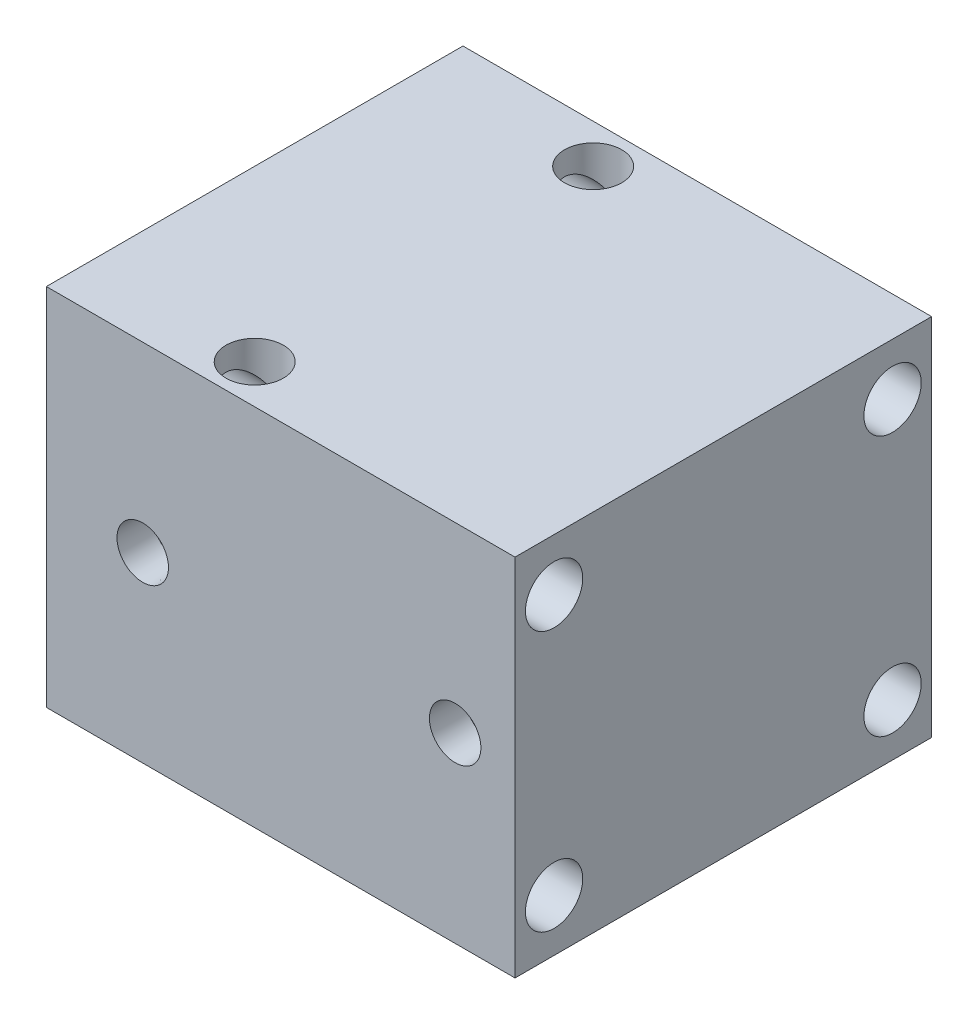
SolidWorks part; units mm, degrees
ref_plane "Front Plane" through (0, 0, 0) normal (0, 0, 1) x (1, 0, 0)
ref_plane "Top Plane" through (0, 0, 0) normal (0, 1, 0) x (1, 0, 0)
ref_plane "Right Plane" through (0, 0, 0) normal (1, 0, 0) x (0, 0, -1)
sketch "Sketch1" plane through (0, 0, 0) normal (0, 1, 0) x (1, 0, 0)
  line L0 (-25, 65) -> (-25, -65) construction
  line L1 (-90, 80) -> (90, 80)
  line L2 (-90, 80) -> (-90, -80)
  line L3 (-90, -80) -> (90, -80)
  line L4 (90, 80) -> (90, -80)
  line L5 (-90, 0) -> (-25, 0) construction
  circle A0 centre (-25, 65) radius 11
  circle A1 centre (-25, -65) radius 11
  dimension "D5" = 22
  dimension "D6" = 22
  dimension "D8" = 65
  dimension "D1" = 160
  dimension "D2" = 80
  dimension "D3" = 180
  dimension "D4" = 90
  dimension "D7" = 130
extrude "H1" add sketch "Sketch1" along normal blind 140
sketch "Sketch2" plane through (-90, 0, 0) normal (-1, 0, 0) x (0, 0, 1)
  line L0 (0, 0) -> (0, 70) construction
  line L1 (80, 70) -> (0, 70) construction
  line L2 (80, 140) -> (80, 0) construction
  circle A0 centre (0, 70) radius 1.5
  dimension "D1" = 3
extrude "CENTER HOLE" cut sketch "Sketch2" against normal blind 60
hole_wizard "1/2 NPT Tapped Hole1" positions "Sketch4" profile "Sketch3" size "1/2" standard "Ansi Inch"
sketch "Sketch4" plane through (0, 0, 80) normal (0, 0, 1) x (1, 0, 0)
  line L0 (-90, 70) -> (90, 70) construction
  line L1 (-90, 140) -> (-90, 0) construction
  line L2 (90, 140) -> (90, 0) construction
  point P0 (67, 70)
  point P1 (-53, 70)
  dimension "D1" = 37
  dimension "D2" = 23
sketch "Sketch3" plane through (67, 70, 80) normal (1, 0, 0) x (0, -1, 0)
  line L0 (0, 0) -> (0, 28.0045)
  line L1 (8.9281, 22.64) -> (0, 28.0045)
  line L2 (-8.9281, 22.64) -> (0, 28.0045) construction
  line L3 (8.9281, 22.64) -> (8.9281, 13.57)
  line L4 (8.9281, 13.57) -> (9.4797, 13.57)
  line L5 (9.4797, 13.57) -> (9.886, 0)
  line L6 (-9.4797, 13.57) -> (-9.886, 0) construction
  line L7 (9.886, 0) -> (0, 0)
  line L8 (0, -6.35) -> (0, 107.95) construction
  line L11 (-8.9281, 13.57) -> (-9.4797, 13.57) construction
  dimension "Tap Drill Dia." = 17.8562
  dimension "Tap Drill Depth" = 22.64
  dimension "Thread Dia." = 19.772
  dimension "Thread Angle" = 3.43
  dimension "Thread Depth" = 13.57
  dimension "Drill Angle" = 118
sketch "Sketch6" plane through (-90, 0, 0) normal (-1, 0, 0) x (0, 0, 1)
  line L0 (-65, 140) -> (-65, 0) construction
  line L1 (65, 140) -> (65, 0) construction
  line L3 (-65, 120) -> (65, 120) construction
  line L5 (-65, 20) -> (65, 20) construction
  circle A0 centre (-65, 120) radius 11
  circle A1 centre (-65, 20) radius 11
  circle A2 centre (65, 120) radius 11
  circle A3 centre (65, 20) radius 11
  dimension "D3" = 22
  dimension "D1" = 50
  dimension "D2" = 100
extrude "MTG HOLE" cut sketch "Sketch6" against normal up to surface (180 mm away)
sketch "Sketch5" plane through (0, 0, 80) normal (0, 0, 1) x (1, 0, 0)
  circle A0 centre (-53, 70) radius 2
  circle A1 centre (67, 70) radius 2
  circle A2 centre (67, 70) radius 9.886 construction
  circle A3 centre (-53, 70) radius 9.886 construction
  dimension "D1" = 4
  dimension "D2" = 4
extrude "OIL HOLE" cut sketch "Sketch5" against normal blind 30
equation "\"D1@Sketch6\"=\"D2@Sketch6\"/2"
equation "\"D5@Sketch1\" = \"D6@Sketch1\""
equation "\"D2@Sketch1\" = \"D1@Sketch1\"/2"
equation "\"D4@Sketch1\"=\"D3@Sketch1\" / 2"
